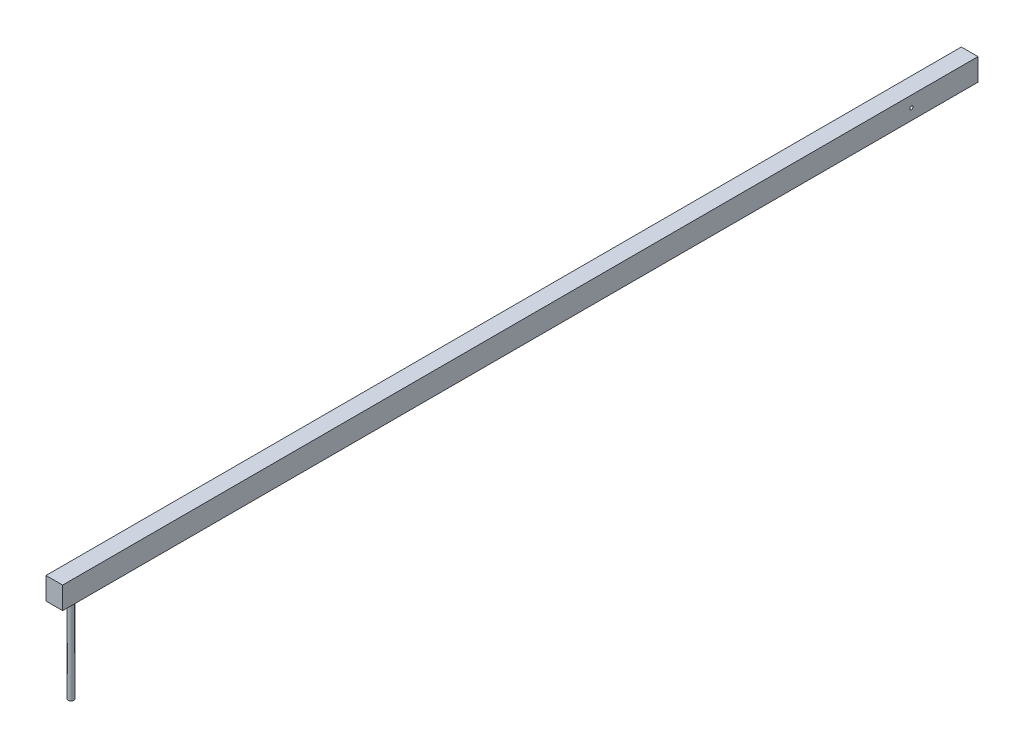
SolidWorks part; units mm, degrees
ref_plane "Plan de face" through (0, 0, 0) normal (0, 0, 1) x (1, 0, 0)
ref_plane "Plan de dessus" through (0, 0, 0) normal (0, 1, 0) x (1, 0, 0)
ref_plane "Plan de droite" through (0, 0, 0) normal (1, 0, 0) x (0, 0, -1)
sketch "Esquisse1" plane through (0, 0, 0) normal (0, 0, 1) x (1, 0, 0)
  line L1 (15, -20) -> (-15, -20)
  line L2 (15, -20) -> (15, 20)
  line L3 (15, 20) -> (-15, 20)
  line L4 (-15, -20) -> (-15, 20)
  line L5 (15, -20) -> (-15, 20) construction
  line L6 (15, 20) -> (-15, -20) construction
  point P0 (0, 0)
  dimension "D1" = 40
  dimension "D2" = 30
extrude "Boss.-Extru.1" add sketch "Esquisse1" along normal mid plane 1650
sketch "Esquisse2" plane through (0, 20, 0) normal (0, 1, 0) x (1, 0, 0)
  line L0 (15, -825) -> (-15, -825) construction
  line L1 (-15, -825) -> (-15, 825) construction
  circle A0 centre (0, -795) radius 5
  dimension "D1" = 10
  dimension "D2" = 30
  dimension "D3" = 15
extrude "Boss.-Extru.2" add sketch "Esquisse2" against normal blind 200
sketch "Esquisse3" plane through (-15, 0, 0) normal (-1, 0, 0) x (0, 0, 1)
  line L0 (-825, 20) -> (-825, -20) construction
  circle A0 centre (-705, 0) radius 3
  dimension "D1" = 6
  dimension "D2" = 120
extrude "Enlèv. mat.-Extru.1" cut sketch "Esquisse3" against normal through all both and the other way through all
